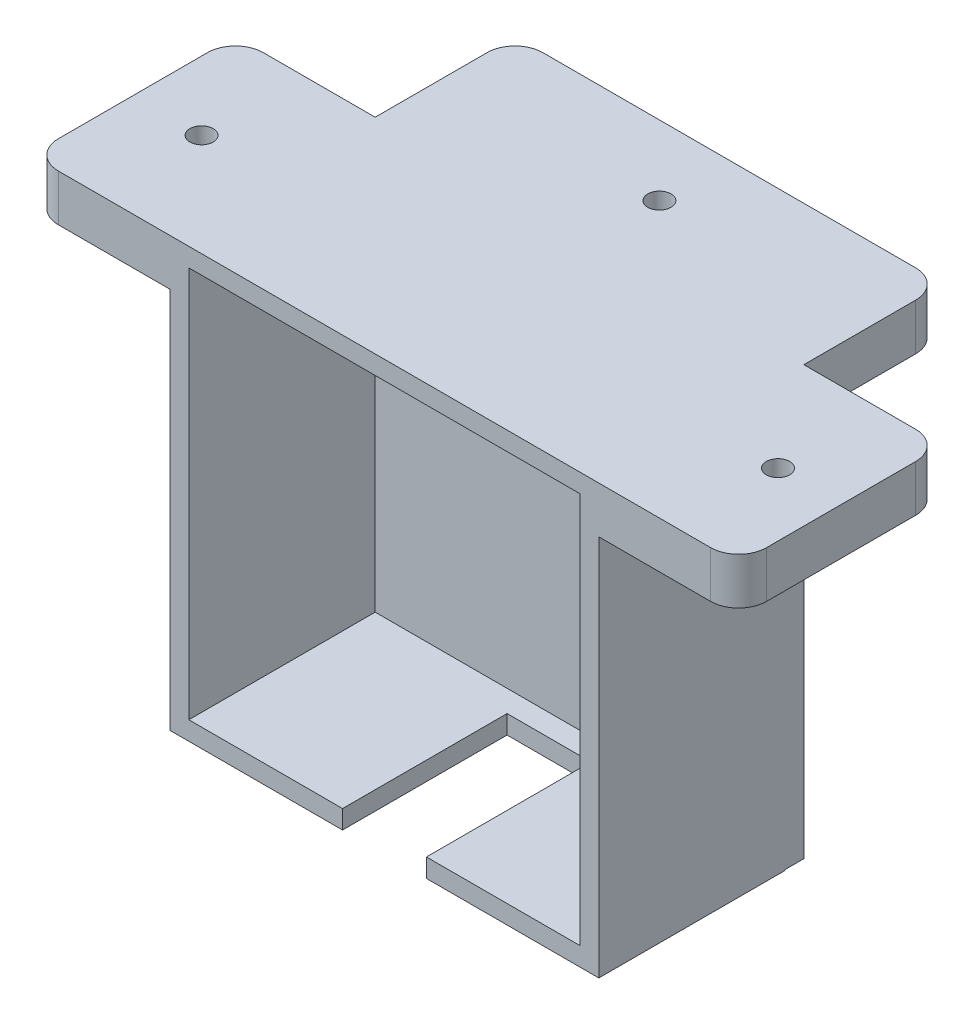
SolidWorks part; units mm, degrees
ref_plane "Front Plane" through (0, 0, 0) normal (0, 0, 1) x (1, 0, 0)
ref_plane "Top Plane" through (0, 0, 0) normal (0, 1, 0) x (1, 0, 0)
ref_plane "Right Plane" through (0, 0, 0) normal (1, 0, 0) x (0, 0, -1)
sketch "Sketch1" plane through (0, 0, 0) normal (0, 0, 1) x (1, 0, 0)
  line L0 (-23, 23) -> (-23, -23)
  line L1 (-21, 21) -> (21, 21)
  line L2 (-21, 21) -> (-21, -21)
  line L3 (-21, -21) -> (21, -21)
  line L4 (21, 21) -> (21, -21)
  line L5 (-23, -23) -> (23, -23)
  line L6 (23, 23) -> (23, -23)
  line L7 (-23, 23) -> (23, 23)
  point P4 (0, 21)
  point P6 (-21, 0)
  dimension "D1" = 42
  dimension "D2" = 42
  dimension "D3" = 2
extrude "Boss-Extrude1" add sketch "Sketch1" along normal blind 20
sketch "Sketch2" plane through (0, 0, 0) normal (0, 0, -1) x (-1, 0, 0)
  line L0 (23, 23) -> (23, -23) construction
  line L1 (-23, 23) -> (23, 23)
  line L2 (-23, 23) -> (-23, -22.9159)
  line L3 (-23, -22.9159) -> (23, -22.9159)
  line L4 (23, 23) -> (23, -22.9159)
extrude "Boss-Extrude2" add sketch "Sketch2" along normal blind 2
sketch "Sketch9" plane through (0, -23, 0) normal (0, -1, 0) x (1, 0, 0)
  line L1 (-4.5, 39.1871) -> (4.5, 39.1871)
  line L2 (-4.5, 39.1871) -> (-4.5, 2.3464)
  line L3 (-4.5, 2.3464) -> (4.5, 2.3464)
  line L4 (4.5, 39.1871) -> (4.5, 2.3464)
  point P4 (0, 2.3464)
  dimension "D1" = 9
extrude "Cut-Extrude3" cut sketch "Sketch9" against normal blind 20
sketch "Sketch11" plane through (0, 23, 0) normal (0, 1, 0) x (1, 0, 0)
  line L0 (14.775, -20) -> (38, -20)
  line L1 (23, -20) -> (-23, -20) construction
  line L2 (38, -20) -> (38, 2)
  line L3 (38, 2) -> (23, 2)
  line L4 (23, 2) -> (23, 17)
  line L5 (23, 17) -> (-23, 17)
  line L6 (-23, 17) -> (-23, 2)
  line L7 (-23, 2) -> (-38, 2)
  line L8 (-38, 2) -> (-38, -20)
  line L9 (-38, -20) -> (-23, -20)
  line L10 (-23, 2) -> (23, 2) construction
  line L11 (23, -20) -> (23, 2) construction
  line L16 (23, -20) -> (23, 2)
  line L17 (23, 2) -> (-23, 2)
  line L18 (-23, 2) -> (-23, -20)
  line L19 (-23, -20) -> (23, -20)
  line L20 (23, -20) -> (23, 2)
  line L21 (23, 2) -> (-23, 2)
  line L22 (-23, 2) -> (-23, -20)
  line L23 (14.775, -20) -> (23, -20)
  dimension "D1" = 15
  dimension "D2" = 15
  dimension "D3" = 15
  dimension "D4" = 0
extrude "Boss-Extrude3" add sketch "Sketch11" against normal blind 5 contours L2 L3 L0 M4 | L5 L6 L4 M5 | L8 L9 L7 M6
sketch "Sketch12" plane through (0, 18, 0) normal (0, -1, 0) x (1, 0, 0)
  line L0 (38, 20) -> (38, -2) construction
  line L1 (23, -17) -> (-23, -17) construction
  line L2 (-23, -17) -> (-23, -2) construction
  circle A0 centre (-30.6312, 9) radius 1.25
  circle A1 centre (0, -9.5) radius 1.25
  circle A2 centre (31.2306, 9) radius 1.25
  point P6 (0, 0)
  point P7 (0, 0)
  point P10 (38, 9)
  point P11 (0, 0)
  point P14 (0, -17)
  point P15 (0, 0)
  point P18 (-23, -9.5)
  dimension "D1" = 2.5
extrude "Cut-Extrude4" cut sketch "Sketch12" against normal blind 10
fillet "Fillet1" radius 3 6 edges at (38, 20.5, -2) (38, 20.5, 20) (-23, 20.5, -17) (23, 20.5, -17) (-38, 20.5, 20) (-38, 20.5, -2)
